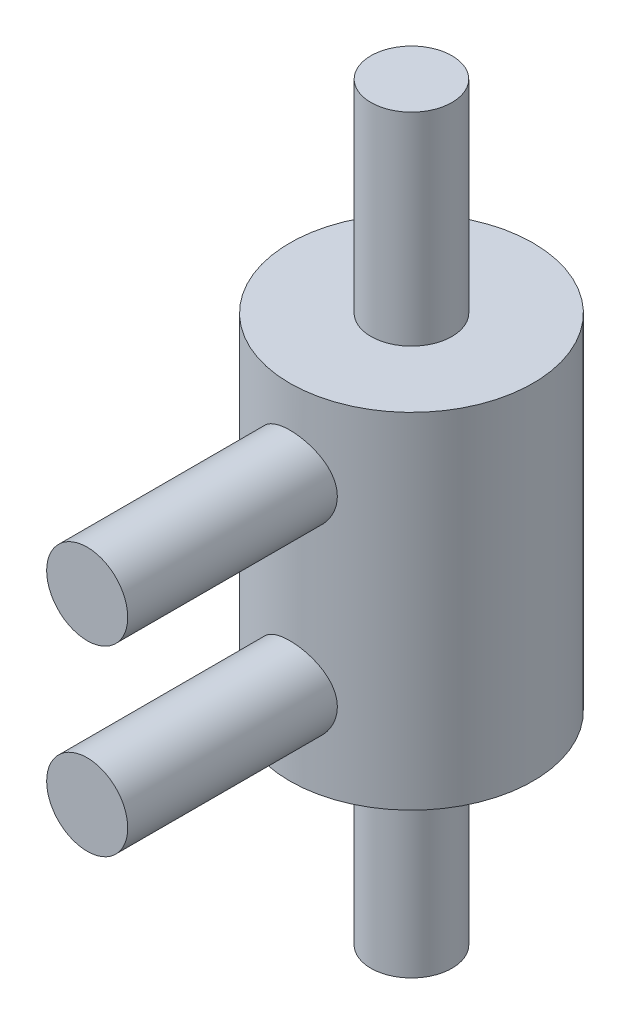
SolidWorks part; units mm, degrees
ref_plane "前视基准面" through (0, 0, 0) normal (0, 0, 1) x (1, 0, 0)
ref_plane "上视基准面" through (0, 0, 0) normal (0, 1, 0) x (1, 0, 0)
ref_plane "右视基准面" through (0, 0, 0) normal (1, 0, 0) x (0, 0, -1)
other "Configuration Table"
sketch "草图1" plane through (0, 0, 0) normal (0, 1, 0) x (1, 0, 0)
  circle A0 centre (0, 0) radius 6
extrude "凸台-拉伸1" add sketch "草图1" along normal blind 17
sketch "草图2" plane through (0, 17, 0) normal (0, 1, 0) x (1, 0, 0)
  circle A0 centre (0, 0) radius 2
extrude "凸台-拉伸2" add sketch "草图2" along normal blind 10
sketch "草图3" plane through (0, 0, 0) normal (0, 0, 1) x (1, 0, 0)
  circle A0 centre (0, 13) radius 2
extrude "凸台-拉伸3" add sketch "草图3" along normal blind 16
ref_plane "基准面1" through (0, 8.5, 0) normal (0, 1, 0) x (1, 0, 0)
mirror "镜向1" about plane through (0, 8.5, 0) normal (0, 1, 0) of "凸台-拉伸2", "凸台-拉伸3"
